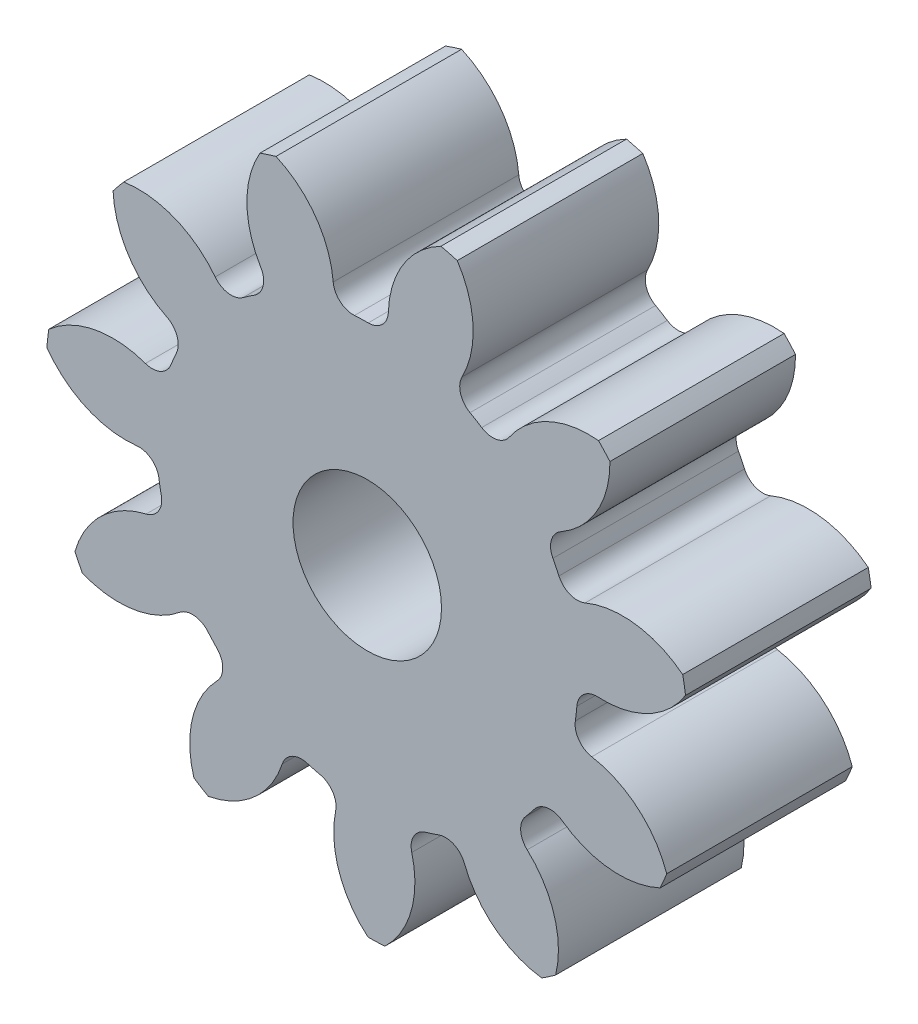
SolidWorks part; units mm, degrees
ref_plane "Front" through (0, 0, 0) normal (0, 0, 1) x (1, 0, 0)
ref_plane "Top" through (0, 0, 0) normal (0, 1, 0) x (1, 0, 0)
ref_plane "Right" through (0, 0, 0) normal (1, 0, 0) x (0, 0, -1)
sketch "Sketch3" plane through (0, 0, 0) normal (0, 0, 1) x (1, 0, 0)
  circle A0 centre (0, 0) radius 220.1333
  dimension "od" = 440.2667
extrude "gearBody" add sketch "Sketch3" along normal blind 127
sketch "Sketch2" plane through (0, 0, 0) normal (0, 0, 1) x (1, 0, 0)
  line L0 (0, 0) -> (161.7098, 66.9824) construction
  line L1 (206.2664, -84.7994) -> (0, 0) construction
  line L2 (0, 0) -> (36.3143, 0) construction
  line L3 (186.1877, 5.4228) -> (180.0935, -47.5564) construction
  line L5 (183.1406, -21.0668) -> (0, 0) construction
  line L7 (0, 0) -> (175.0334, 0) construction
  arc A0 (175.021, 2.0858) -> (169.9761, -41.7711) centre (0, 0) ccw construction
  arc A1 (217.8279, 31.7756) -> (204.9237, -80.4051) centre (0, 0) ccw construction
  arc A2 (186.1877, 5.4228) -> (180.0935, -47.5564) centre (0, 0) ccw construction
  arc A3 (142.3802, -21.0873) -> (143.4495, -11.7919) centre (0, 0) ccw
  arc A4 (206.2664, -84.7994) -> (153.6492, -36.6859) centre (142.2773, -101.9503) ccw
  arc A5 (206.2664, -84.7994) -> (220.1333, 35.7502) centre (0, 0) ccw
  arc A6 (220.1333, 35.7502) -> (157.9659, 0.8406) centre (161.7098, 66.9824) cw
  arc A7 (143.4495, -11.7919) -> (157.9659, 0.8406) centre (157.1869, -12.9211) cw
  arc A8 (153.6492, -36.6859) -> (142.3802, -21.0873) centre (156.0152, -23.1068) cw
  point P6 (220.1333, 35.7502)
  point P22 (206.2664, -84.7994)
  dimension "baseDia" = 350.0668
  dimension "od" = 440.2667
  dimension "pd" = 372.5333
  dimension "rd" = 287.8667
  dimension "rFillet" = 13.7837
  dimension "pointX" = 220.1333
  dimension "pointY" = 35.7502
  dimension "CTT" = 52.9791
  dimension "flankCenterAngle" = 22.5
extrude "toothCut" cut sketch "Sketch2" along normal through all
pattern_circular "CirPattern1" count 11 over 360 about axis through (0, 0, 0) along (0, 0, 1) of "toothCut"
sketch "hub1Dia" plane through (0, 0, 0) normal (0, 0, -1) x (-1, 0, 0)
  circle A0 centre (0, 0) radius 12.7
  dimension "hub1Dia" = 25.4
sketch "hub2Dia" plane through (0, 0, 127) normal (0, 0, 1) x (1, 0, 0)
  circle A0 centre (0, 0) radius 12.7
  dimension "hub2dia" = 25.4
sketch "boreDia" plane through (0, 0, 0) normal (0, 0, 1) x (1, 0, 0)
  circle A0 centre (0, 0) radius 50.8
  dimension "boreDia" = 101.6
extrude "bore" cut sketch "boreDia" against normal mid plane 25400
